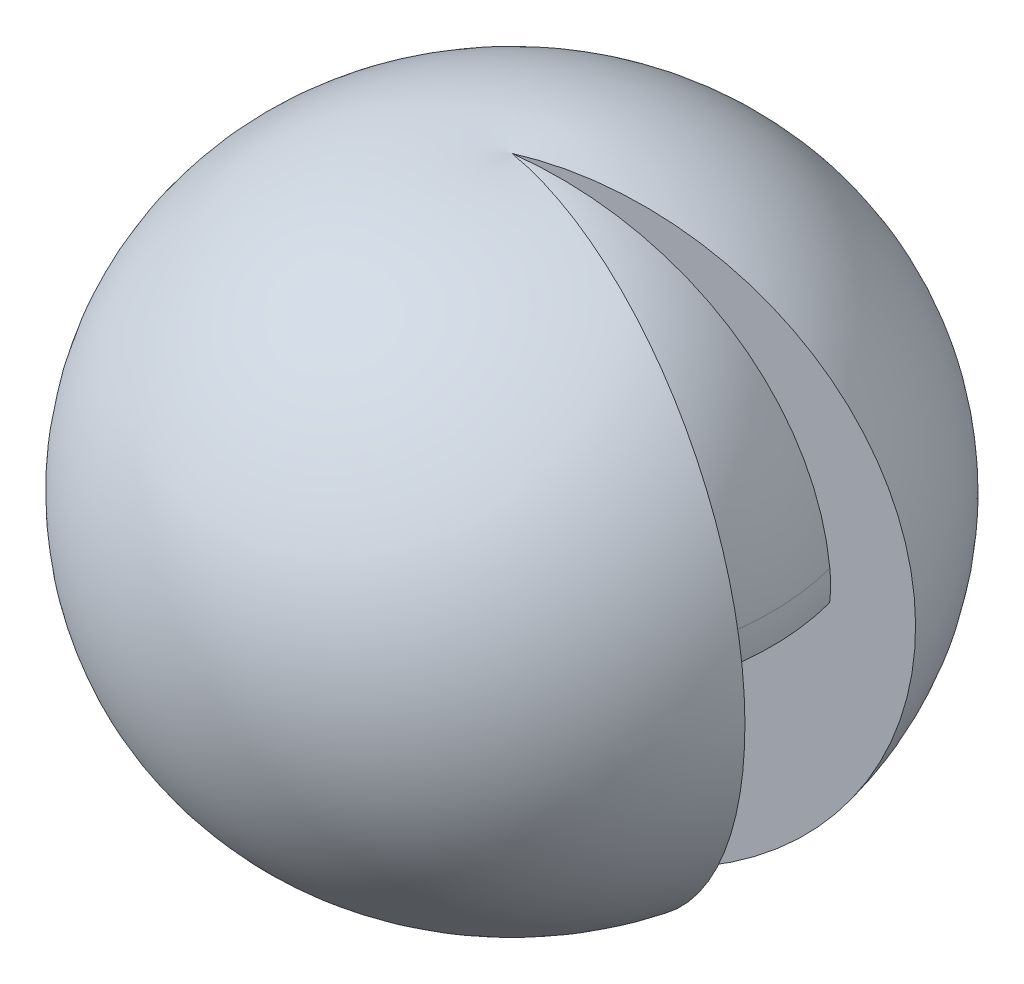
SolidWorks part; units mm, degrees
ref_plane "Piano1 (Front/Back)" through (0, 0, 0) normal (0, 0, 1) x (1, 0, 0)
ref_plane "Piano2 (Top/Bottom)" through (0, 0, 0) normal (0, 1, 0) x (1, 0, 0)
ref_plane "Piano3 (Left/Right)" through (0, 0, 0) normal (1, 0, 0) x (0, 0, -1)
sketch "Posizione calibrazione" plane through (0, 0, 0) normal (0, 0, 1) x (1, 0, 0)
  line L0 (0, 0) -> (0, 430) construction
  line L1 (0, 430) -> (-150, 430) construction
  line L2 (-150, 430) -> (-150, 1020) construction
  line L3 (-150, 1020) -> (-150, 1150) construction
  line L4 (-150, 1150) -> (-834, 1150) construction
  line L5 (-834, 1150) -> (-934, 1150) construction
  line L6 (-834, 1150) -> (-150, 1020) construction
  point P3 (-250, 1150)
  dimension "D1" = 430
  dimension "D2" = 150
  dimension "D3" = 590
  dimension "D4" = 130
  dimension "D5" = 100
  dimension "D6" = 584
  dimension "D7" = 100
  dimension "D8" = 1150
  dimension "D9" = 934
sketch "Posizione 1" plane through (0, 0, 0) normal (0, 0, 1) x (1, 0, 0)
  line L0 (0, 0) -> (0, 430) construction
  line L1 (0, 430) -> (-150, 430) construction
  line L2 (-150, 430) -> (-445, 940.955) construction
  line L3 (-445, 940.955) -> (-567.16, 896.4924) construction
  line L4 (-567.16, 896.4924) -> (-333.2183, 253.7426) construction
  line L5 (-333.2183, 253.7426) -> (-445, 940.955) construction
  line L6 (-150, 430) -> (-150, 1020) construction
  line L7 (-150, 1020) -> (-150, 1150) construction
  line L8 (-150, 1150) -> (-834, 1150) construction
  line L9 (-445, 940.955) -> (-489.4626, 1063.115) construction
  dimension "D1" = 30
  dimension "D2" = 170
sketch "Posizione 1-2" plane through (0, 0, 0) normal (0, 0, 1) x (1, 0, 0)
  line L0 (0, 0) -> (0, 430) construction
  line L1 (0, 430) -> (-150, 430) construction
  line L2 (-150, 430) -> (-739.4385, 404.2646) construction
  line L3 (-739.4385, 404.2646) -> (-827.2652, 308.4185) construction
  line L4 (-827.2652, 308.4185) -> (-322.9675, -153.6852) construction
  line L5 (-322.9675, -153.6852) -> (-739.4385, 404.2646) construction
  line L6 (-739.4385, 404.2646) -> (-835.2845, 492.0913) construction
  line L7 (-150, 1020) -> (-150, 1150) construction
  line L8 (-150, 1150) -> (-834, 1150) construction
  line L9 (-150, 430) -> (-150, 1020) construction
  dimension "D1" = 92.5
  dimension "D2" = 135
sketch "Posizione 2" plane through (0, 0, 0) normal (0, 0, 1) x (1, 0, 0)
  line L0 (0, 0) -> (0, 430) construction
  line L1 (0, 430) -> (-150, 430) construction
  line L2 (-150, 430) -> (-399.3448, -104.7216) construction
  line L3 (-399.3448, -104.7216) -> (-432.9913, -230.292) construction
  line L4 (-432.9913, -230.292) -> (227.702, -407.3242) construction
  line L5 (227.702, -407.3242) -> (-399.3448, -104.7216) construction
  line L6 (-399.3448, -104.7216) -> (-524.9151, -71.0751) construction
  line L7 (-150, 430) -> (-150, 1020) construction
  line L8 (-150, 1020) -> (-150, 1150) construction
  line L9 (-150, 1150) -> (-834, 1150) construction
  dimension "D1" = 155
  dimension "D2" = 100
sketch "Posizione 3" plane through (0, 0, 0) normal (0, 0, 1) x (1, 0, 0)
  line L0 (0, 0) -> (0, 430) construction
  line L1 (0, 430) -> (-150, 430) construction
  line L2 (-150, 430) -> (-399.3448, -104.7216) construction
  line L3 (-399.3448, -104.7216) -> (-525.351, -72.7463) construction
  line L4 (-525.351, -72.7463) -> (-693.5903, -735.7331) construction
  line L5 (-693.5903, -735.7331) -> (-399.3448, -104.7216) construction
  line L6 (-399.3448, -104.7216) -> (-367.3695, 21.2847) construction
  line L8 (-150, 1150) -> (-834, 1150) construction
  line L9 (-150, 430) -> (-150, 1020) construction
  line L10 (-150, 1020) -> (-150, 1150) construction
  dimension "D1" = 155
  dimension "D2" = 10.761
sketch "Posizione 4" plane through (0, 0, 0) normal (0, 0, 1) x (1, 0, 0)
  line L0 (0, 0) -> (0, 430) construction
  line L1 (0, 430) -> (-150, 430) construction
  line L2 (-150, 430) -> (437.7549, 481.4219) construction
  line L3 (437.7549, 481.4219) -> (473.0666, 356.3096) construction
  line L4 (473.0666, 356.3096) -> (1131.3497, 542.1036) construction
  line L5 (1131.3497, 542.1036) -> (437.7549, 481.4219) construction
  line L6 (-150, 430) -> (-150, 1020) construction
  line L7 (-150, 1020) -> (-150, 1150) construction
  line L8 (-150, 1150) -> (-834, 1150) construction
  line L9 (437.7549, 481.4219) -> (312.6426, 446.1102) construction
  dimension "D1" = 85
sketch "Posizione 5" plane through (0, 0, 0) normal (0, 0, 1) x (1, 0, 0)
  line L0 (0, 0) -> (0, 430) construction
  line L1 (0, 430) -> (-150, 430) construction
  line L2 (-150, 430) -> (437.7549, 481.4219) construction
  line L3 (437.7549, 481.4219) -> (449.0851, 351.9166) construction
  line L4 (449.0851, 351.9166) -> (1130.4823, 411.5311) construction
  line L5 (1130.4823, 411.5311) -> (437.7549, 481.4219) construction
  line L6 (437.7549, 481.4219) -> (308.2496, 470.0916) construction
  line L7 (437.7549, 481.4219) -> (473.0666, 356.3096) construction
  line L8 (473.0666, 356.3096) -> (1131.3497, 542.1036) construction
sketch "Posizione 6" plane through (0, 0, 0) normal (0, 0, 1) x (1, 0, 0)
  line L0 (0, 0) -> (0, 430) construction
  line L1 (0, 430) -> (-150, 430) construction
  line L2 (-150, 430) -> (437.7549, 481.4219) construction
  line L3 (437.7549, 481.4219) -> (449.0851, 610.9272) construction
  line L4 (449.0851, 610.9272) -> (-232.3121, 670.5417) construction
  line L5 (-232.3121, 670.5417) -> (437.7549, 481.4219) construction
  line L6 (437.7549, 481.4219) -> (567.2602, 470.0916) construction
  line L7 (-150, 430) -> (-150, 1020) construction
  line L8 (-150, 1020) -> (-150, 1150) construction
  line L9 (-150, 1150) -> (-834, 1150) construction
  dimension "D1" = 85
  dimension "D2" = 170
sketch "Area Lavoro" plane through (0, 0, 0) normal (0, 0, 1) x (1, 0, 0)
  line L0 (-150, 430) -> (-739.4385, 404.2646) construction
  line L1 (0, 430) -> (-150, 430) construction
  line L2 (449.0851, 610.9272) -> (-232.3121, 670.5417) construction
  line L3 (-150, 430) -> (437.7549, 481.4219) construction
  arc A0 (-333.2183, 253.7426) -> (-232.3121, 670.5417) centre (-150, 430) cw
  arc A1 (-333.2183, 253.7426) -> (227.702, -407.3242) centre (109.6846, 61.0431) ccw
  arc A2 (227.702, -407.3242) -> (-693.5903, -735.7331) centre (-399.3448, -104.7216) cw
  arc A3 (-693.5903, -735.7331) -> (1131.3497, 542.1036) centre (-150, 430) cw
  arc A4 (1107.8218, 670.5417) -> (-232.3121, 670.5417) centre (437.7549, 481.4219) ccw
  arc A5 (1130.4823, 411.5311) -> (1131.3497, 542.1036) centre (437.7549, 481.4219) ccw
  arc A6 (1130.4823, 411.5311) -> (1107.8218, 670.5417) centre (-150, 430) ccw
sketch "Schizzo1" plane through (0, 0, 0) normal (0, 0, 1) x (1, 0, 0)
  line L1 (0, 0) -> (0, 1022.8336) construction
  line L2 (0, -409.3454) -> (0, -675.0546)
  line L3 (0, 1022.8336) -> (0, 1707.4679)
  arc A5 (1131.3497, 542.1036) -> (-693.5903, -735.7331) centre (-150, 430) ccw construction
  arc A6 (-693.5903, -735.7331) -> (227.702, -407.3242) centre (-399.3448, -104.7216) ccw construction
  arc A7 (-333.2183, 253.7426) -> (227.702, -407.3242) centre (109.6846, 61.0431) ccw construction
  arc A8 (-232.3121, 670.5417) -> (-333.2183, 253.7426) centre (-150, 430) ccw construction
  arc A9 (1107.8218, 670.5417) -> (-232.3121, 670.5417) centre (437.7549, 481.4219) ccw construction
  arc A10 (0, 1707.4679) -> (-693.5903, -735.7331) centre (-150, 430) ccw
  arc A11 (-693.5903, -735.7331) -> (0, -675.0546) centre (-399.3448, -104.7216) ccw
  arc A12 (-333.2183, 253.7426) -> (0, -409.3454) centre (109.6846, 61.0431) ccw
  arc A13 (-232.3121, 670.5417) -> (-333.2183, 253.7426) centre (-150, 430) ccw
  arc A14 (0, 1022.8336) -> (-232.3121, 670.5417) centre (437.7549, 481.4219) ccw
revolve "Rivoluzione3" add sketch "Schizzo1" angle 330 mid plane about L1
sketch "Schizzo2" plane through (0, 0, 0) normal (0, 0, 1) x (1, 0, 0)
  line L0 (0, 0) -> (0, 1022.8336) construction
  line L1 (0, 1022.8336) -> (0, 1707.4679)
  line L2 (0, -409.3454) -> (0, -675.0546)
  arc A0 (1107.8218, 670.5417) -> (-232.3121, 670.5417) centre (437.7549, 481.4219) ccw construction
  arc A12 (1131.3497, 542.1036) -> (-693.5903, -735.7331) centre (-150, 430) ccw
  arc A13 (-693.5903, -735.7331) -> (227.702, -407.3242) centre (-399.3448, -104.7216) ccw
  arc A14 (-333.2183, 253.7426) -> (227.702, -407.3242) centre (109.6846, 61.0431) ccw
  arc A15 (-232.3121, 670.5417) -> (-333.2183, 253.7426) centre (-150, 430) ccw
  arc A16 (1107.8218, 670.5417) -> (-232.3121, 670.5417) centre (437.7549, 481.4219) ccw
  arc A17 (1130.4823, 411.5311) -> (1107.8218, 670.5417) centre (-150, 430) ccw
  arc A18 (1130.4823, 411.5311) -> (1131.3497, 542.1036) centre (437.7549, 481.4219) ccw
  arc A19 (1131.3497, 542.1036) -> (0, 1707.4679) centre (-150, 430) ccw
  arc A20 (0, -675.0546) -> (227.702, -407.3242) centre (-399.3448, -104.7216) ccw
  arc A21 (0, -409.3454) -> (227.702, -407.3242) centre (109.6846, 61.0431) ccw
  arc A23 (1107.8218, 670.5417) -> (0, 1022.8336) centre (437.7549, 481.4219) ccw
  arc A24 (1130.4823, 411.5311) -> (1107.8218, 670.5417) centre (-150, 430) ccw
  arc A25 (1130.4823, 411.5311) -> (1131.3497, 542.1036) centre (437.7549, 481.4219) ccw
  dimension "D1" = 0
revolve "Rivoluzione4" add sketch "Schizzo2" angle 330 mid plane about L0
